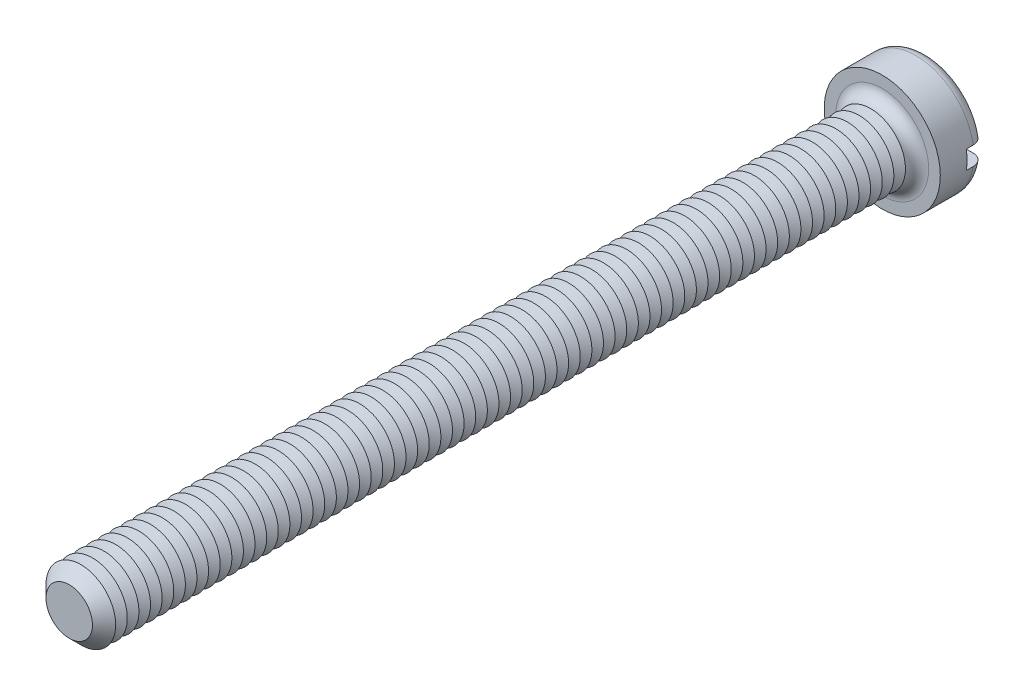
SolidWorks part; units mm, degrees
ref_plane "Front Plane" through (0, 0, 0) normal (0, 0, 1) x (1, 0, 0)
ref_plane "Top Plane" through (0, 0, 0) normal (0, 1, 0) x (1, 0, 0)
ref_plane "Right Plane" through (0, 0, 0) normal (1, 0, 0) x (0, 0, -1)
sketch "Sketch3" plane through (0, 0, 0) normal (0, 0, 1) x (1, 0, 0)
  circle A0 centre (0, 0) radius 5
  dimension "D1" = 10
extrude "Boss-Extrude2" add sketch "Sketch3" against normal blind 3.9
sketch "Sketch4" plane through (0, 0, 0) normal (0, 0, 1) x (1, 0, 0)
  circle A0 centre (0, 0) radius 3
  dimension "D1" = 6
extrude "Boss-Extrude3" add sketch "Sketch4" along normal blind 70
fillet "Fillet1" radius 1 2 edges at (5, 0, -3.9) (3, 0, 0)
chamfer "Chamfer1" distance 1 angle 45 1 edges at (3, 0, 70)
sketch "Sketch5" plane through (0, 0, 0) normal (1, 0, 0) x (0, 0, -1)
  line L0 (1.6944, 0) -> (-7.6738, 0) construction
sketch "Sketch6" plane through (0, 0, 0) normal (1, 0, 0) x (0, 0, -1)
  line L0 (-1, 3) -> (-1.5, 2.134)
  line L1 (-1.5, 2.134) -> (-2, 3)
  line L2 (-1, 3) -> (-69, 3) construction
  line L3 (-2, 3) -> (-1, 3)
  dimension "D1" = 1
revolve "Cut-Revolve1" cut sketch "Sketch6" angle 360 about L0
pattern_linear "LPattern1" count 68 spacing 1 along (0, 0, 1) of "Cut-Revolve1"
sketch "Sketch8" plane through (0, 0, -3.9) normal (0, 0, -1) x (-1, 0, 0)
  line L1 (5, -0.8) -> (-5, -0.8)
  line L2 (5, -0.8) -> (5, 0.8)
  line L3 (5, 0.8) -> (-5, 0.8)
  line L4 (-5, -0.8) -> (-5, 0.8)
  line L5 (5, -0.8) -> (-5, 0.8) construction
  line L6 (5, 0.8) -> (-5, -0.8) construction
  point P0 (0, 0)
  dimension "D1" = 10
  dimension "D2" = 1.6
extrude "Cut-Extrude1" cut sketch "Sketch8" against normal blind 1.6
